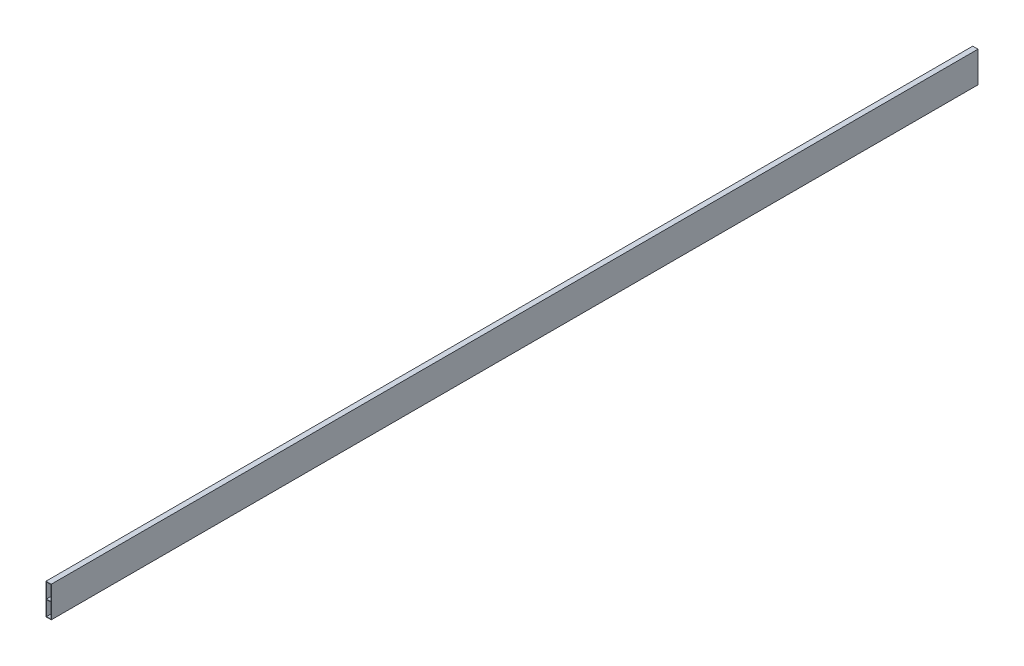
SolidWorks part; units mm, degrees
ref_plane "Plan de face" through (0, 0, 0) normal (0, 0, 1) x (1, 0, 0)
ref_plane "Plan de dessus" through (0, 0, 0) normal (0, 1, 0) x (1, 0, 0)
ref_plane "Plan de droite" through (0, 0, 0) normal (1, 0, 0) x (0, 0, -1)
sketch "Esquisse1" plane through (0, 0, 0) normal (0, 0, 1) x (1, 0, 0)
  line L0 (0, 56.1059) -> (0, -63.7183) construction
  line L1 (-94.3087, 0) -> (85.5686, 0) construction
  line L3 (-8.5, 50) -> (8.5, 50)
  line L4 (-8.5, 50) -> (-8.5, -50)
  line L5 (-8.5, -50) -> (8.5, -50)
  line L6 (8.5, 50) -> (8.5, -50)
  dimension "D1" = 17
  dimension "D2" = 100
extrude "Profil de base" add sketch "Esquisse1" along normal blind 3000 thin
sketch "Esquisse2" plane through (0, 0, 0) normal (0, 0, 1) x (1, 0, 0)
  line L0 (-7, 0) -> (7, 0)
  line L1 (-7, 48.5) -> (-7, -48.5) construction
  line L2 (7, -48.5) -> (7, 48.5) construction
extrude "Nervure" add sketch "Esquisse2" along normal up to surface (3000 mm away) thin
